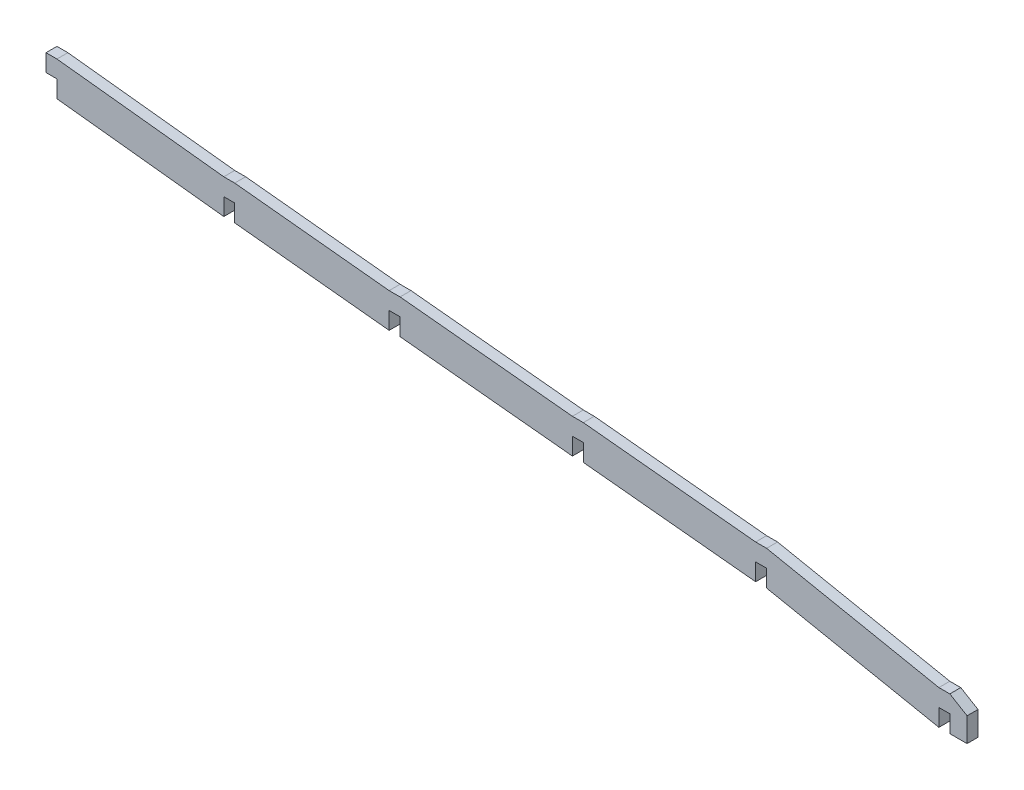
SolidWorks part; units mm, degrees
ref_plane "Front Plane" through (0, 0, 0) normal (0, 0, 1) x (1, 0, 0)
ref_plane "Top Plane" through (0, 0, 0) normal (0, 1, 0) x (1, 0, 0)
ref_plane "Right Plane" through (0, 0, 0) normal (1, 0, 0) x (0, 0, -1)
sketch "Sketch1" plane through (0, 0, 0) normal (0, 0, 1) x (1, 0, 0)
  line L0 (0, 0) -> (0, 45) construction
  line L1 (0, 45) -> (3.175, 45)
  line L2 (3.175, 45) -> (3.175, 0) construction
  line L3 (3.175, 0) -> (53.175, 0) construction
  line L4 (53.175, 0) -> (53.175, 40) construction
  line L5 (53.175, 40) -> (56.35, 40)
  line L6 (56.35, 40) -> (56.35, 0) construction
  line L7 (56.35, 0) -> (106.35, 0) construction
  line L8 (106.35, 0) -> (106.35, 35) construction
  line L9 (106.35, 35) -> (109.525, 35)
  line L10 (109.525, 35) -> (109.525, 0) construction
  line L11 (109.525, 0) -> (159.525, 0) construction
  line L12 (159.525, 0) -> (159.525, 25) construction
  line L13 (159.525, 25) -> (162.7, 25)
  line L14 (162.7, 25) -> (162.7, 5) construction
  line L15 (0, 45) -> (0, 40)
  line L16 (53.175, 40) -> (53.175, 45) construction
  line L17 (-44.81, 49.612) -> (-47.985, 49.612)
  line L18 (-47.985, 49.612) -> (-47.985, 0) construction
  line L19 (0, 50) -> (3.175, 50)
  line L20 (3.175, 45) -> (3.175, 40)
  line L21 (106.35, 35) -> (106.35, 40) construction
  line L22 (159.525, 25) -> (159.525, 30) construction
  line L23 (3.175, 50) -> (53.175, 45)
  line L24 (53.175, 45) -> (56.35, 45)
  line L25 (56.35, 45) -> (106.35, 40)
  line L26 (106.35, 40) -> (109.525, 40)
  line L27 (53.175, 40) -> (53.175, 35)
  line L28 (159.525, 30) -> (162.7, 30)
  line L29 (3.175, 40) -> (53.175, 35)
  line L30 (56.35, 40) -> (56.35, 35)
  line L31 (56.35, 35) -> (106.35, 30)
  line L32 (106.35, 30) -> (106.35, 35)
  line L33 (162.7, 25) -> (162.7, 20)
  line L34 (162.7, 20) -> (167.7, 20)
  line L35 (167.7, 20) -> (167.7, 27)
  line L36 (109.525, 35) -> (109.525, 30)
  line L37 (109.525, 30) -> (159.525, 20)
  line L38 (159.525, 20) -> (159.525, 25)
  line L39 (162.7, 30) -> (167.7, 27)
  line L40 (0, 0) -> (-44.81, 0) construction
  line L41 (-44.81, 0) -> (-44.81, 49.612) construction
  line L42 (-44.81, 49.612) -> (-44.81, 44.612)
  line L43 (-44.81, 44.612) -> (0, 40)
  line L44 (109.525, 40) -> (159.525, 30)
  line L45 (-47.985, 49.612) -> (-47.985, 44.612)
  line L46 (-44.81, 49.612) -> (-44.81, 54.612) construction
  line L47 (-96.395, 55) -> (-96.395, 60) construction
  line L48 (-47.985, 0) -> (-96.395, 0) construction
  line L49 (-96.395, 0) -> (-96.395, 50) construction
  line L50 (-96.395, 50) -> (-96.395, 55)
  line L51 (-96.395, 55) -> (-99.57, 55)
  line L54 (-96.395, 50) -> (-47.985, 44.612)
  line L55 (0, 50) -> (-44.81, 54.612)
  line L56 (-44.81, 54.612) -> (-47.985, 54.612)
  line L57 (-47.985, 54.612) -> (-96.395, 60)
  line L58 (-96.395, 60) -> (-99.57, 60)
  line L61 (-99.57, 55) -> (-99.57, 60)
extrude "Boss-Extrude1" add sketch "Sketch1" along normal blind 3.175
